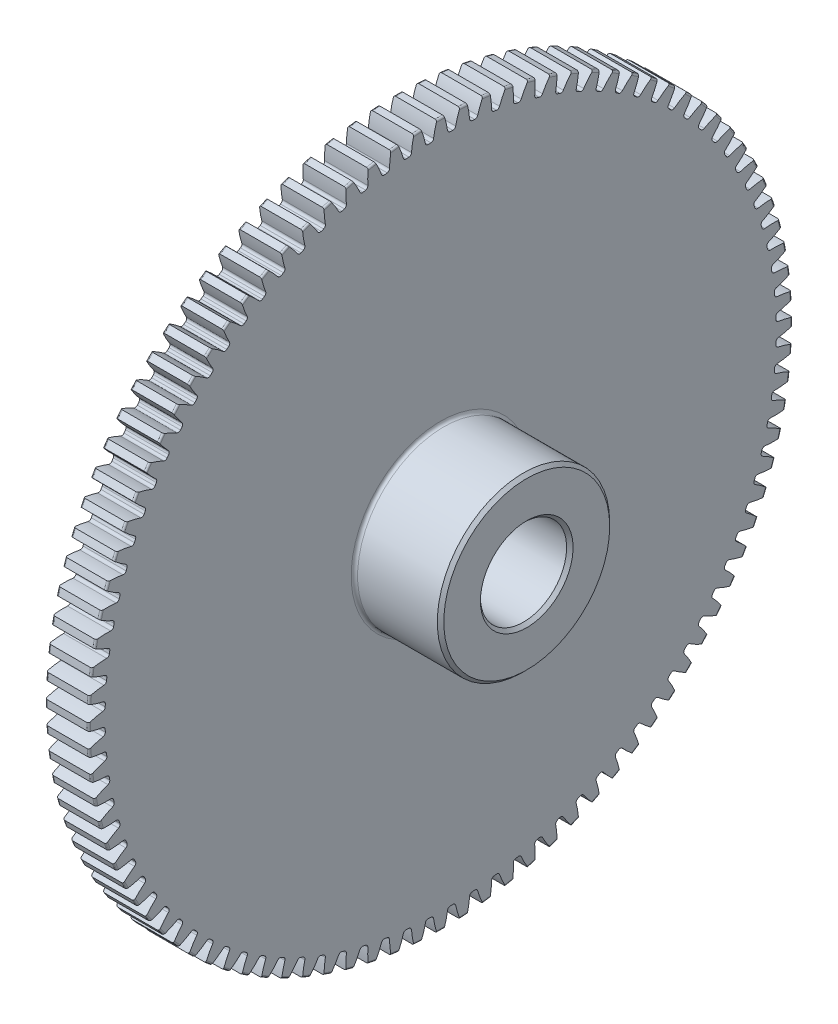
SolidWorks part; units mm, degrees
ref_plane "Front Plane" through (0, 0, 0) normal (0, 0, 1) x (1, 0, 0)
ref_plane "Top Plane" through (0, 0, 0) normal (0, 1, 0) x (1, 0, 0)
ref_plane "Right Plane" through (0, 0, 0) normal (1, 0, 0) x (0, 0, -1)
imported_body "Imported3"
sketch "Sketch1" plane through (0, 0, 0) normal (0, 0, 1) x (1, 0, 0)
  line L0 (1.5875, 6.5881) -> (1.5875, 0)
  line L1 (1.5875, 0) -> (7.9375, 0)
  line L2 (7.9375, 0) -> (7.9375, 6.1119)
  line L3 (7.9375, 6.1119) -> (7.6994, 6.35)
  line L4 (7.6994, 6.35) -> (1.8256, 6.35)
  line L5 (1.5862, 0) -> (7.9375, 0) construction
  arc A0 (1.8256, 6.35) -> (1.5875, 6.5881) centre (1.8256, 6.5881) cw
revolve "Revolve1" add sketch "Sketch1" angle 360 about L5
ref_plane "Plane1" through (0, 0, 0) normal (0, 0, -1) x (-1, 0, 0)
sketch "Sketch2" plane through (0, 0, 0) normal (0, 0, -1) x (-1, 0, 0)
  line L0 (-7.9375, 3.4131) -> (-7.9375, 0)
  line L1 (-7.9375, 0) -> (1.5875, 0)
  line L2 (1.5875, 0) -> (1.5875, 3.4131)
  line L3 (1.5875, 3.4131) -> (1.3494, 3.175)
  line L4 (1.3494, 3.175) -> (-7.6994, 3.175)
  line L5 (-7.6994, 3.175) -> (-7.9375, 3.4131)
  line L6 (-7.9375, 0) -> (1.5875, 0) construction
revolve "Cut-Revolve1" cut sketch "Sketch2" angle 360 about L6
